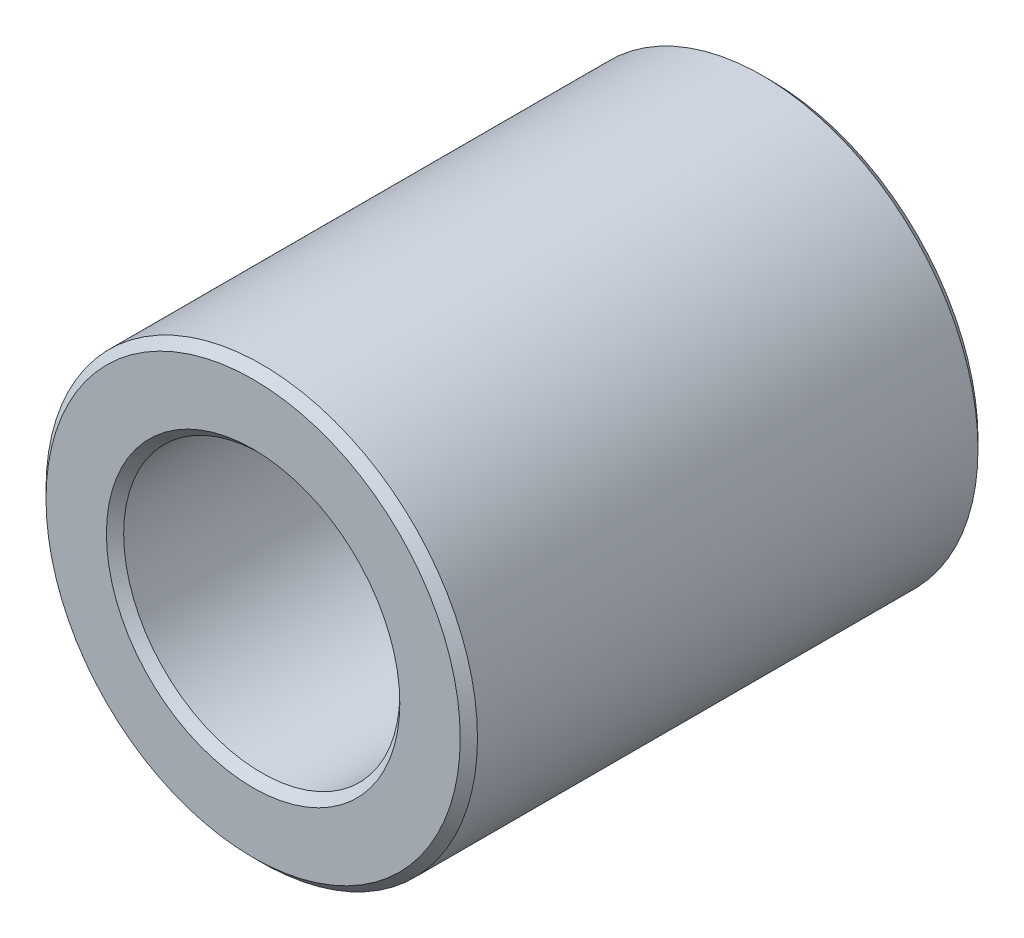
SolidWorks part; units mm, degrees
ref_plane "Front Plane" through (0, 0, 0) normal (0, 0, 1) x (1, 0, 0)
ref_plane "Top Plane" through (0, 0, 0) normal (0, 1, 0) x (1, 0, 0)
ref_plane "Right Plane" through (0, 0, 0) normal (1, 0, 0) x (0, 0, -1)
sketch "Sketch1" plane through (0, 0, 0) normal (0, 0, 1) x (1, 0, 0)
  circle A0 centre (0, 0) radius 5
  circle A1 centre (0, 0) radius 3.2
  dimension "D1" = 10
  dimension "D2" = 6.4
extrude "Boss-Extrude2" add sketch "Sketch1" along normal mid plane 12
chamfer "Chamfer3" distance 0.2 angle 45 4 edges at (5, 0, 6) (5, 0, -6) (3.2, 0, -6) (3.2, 0, 6)
